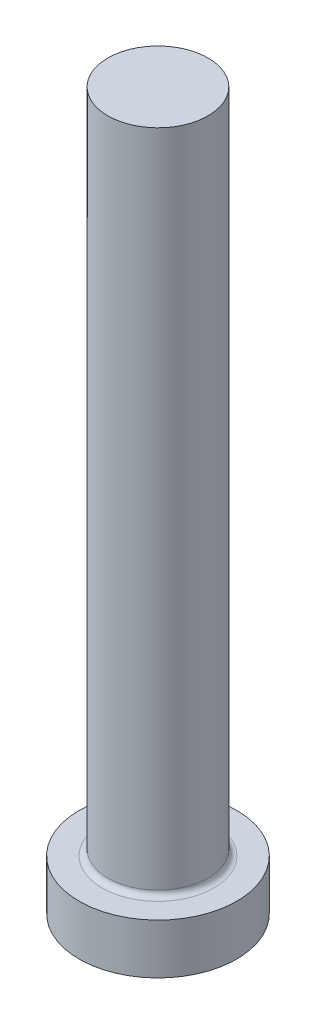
SolidWorks part; units mm, degrees
ref_plane "Plano frontal" through (0, 0, 0) normal (0, 0, 1) x (1, 0, 0)
ref_plane "Plano superior" through (0, 0, 0) normal (0, 1, 0) x (1, 0, 0)
ref_plane "Plano direito" through (0, 0, 0) normal (1, 0, 0) x (0, 0, -1)
sketch "Esboço1" plane through (0, 0, 0) normal (0, 0, 1) x (1, 0, 0)
  line L0 (0, 0) -> (11, 0)
  line L1 (11, 0) -> (11, 7)
  line L2 (11, 7) -> (7.8, 7)
  line L3 (7, 7.8) -> (7, 100)
  line L4 (7, 100) -> (0, 100)
  line L5 (0, 100) -> (0, 0) construction
  line L6 (0, 0) -> (0, 100)
  arc A0 (7.8, 7) -> (7, 7.8) centre (7.8, 7.8) cw
  dimension "D3" = 0.8
  dimension "D1" = 22
  dimension "D2" = 14
  dimension "D4" = 7
  dimension "D5" = 100
revolve "Revolução1" add sketch "Esboço1" angle 360 about L5
sketch "Esboço2"
  dimension "D1" = 0.825
  dimension "D2" = 1.925
  dimension "D3" = 1.2375
  dimension "D4" = 5.9125
wrap "Envolver1" sketch "Esboço2" wrap type deboss source sketch "Esboço2" thickness 0.1 parameters "D1"=0.1
